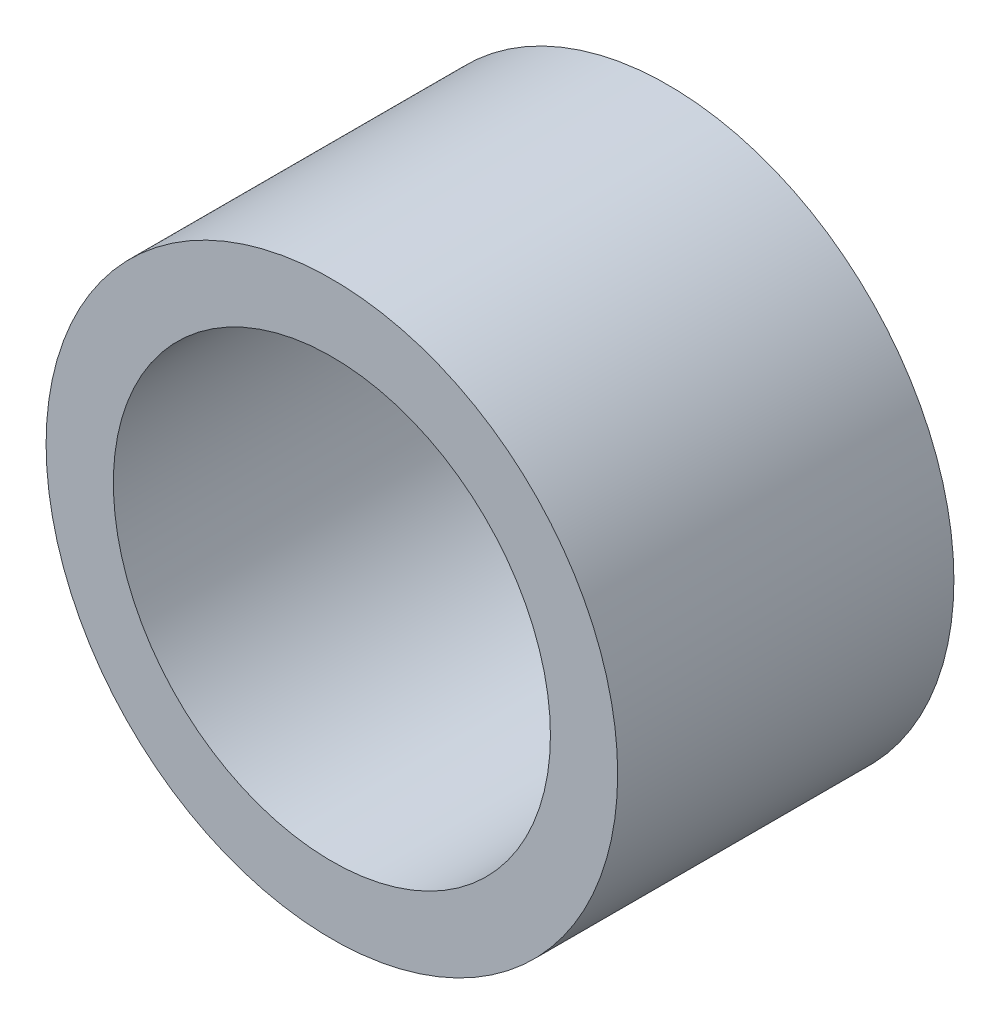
SolidWorks part; units mm, degrees
ref_plane "Plan1" through (0, 0, 0) normal (0, 0, 1) x (1, 0, 0)
ref_plane "Plan2" through (0, 0, 0) normal (0, 1, 0) x (1, 0, 0)
ref_plane "Plan3" through (0, 0, 0) normal (1, 0, 0) x (0, 0, -1)
sketch "Esquisse1" plane through (0, 0, 0) normal (0, 0, 1) x (1, 0, 0)
  circle A0 centre (0, 0) radius 8.5
  dimension "D1" = 17
extrude "Base-Extru.-Mince" add sketch "Esquisse1" along normal blind 10 thin
